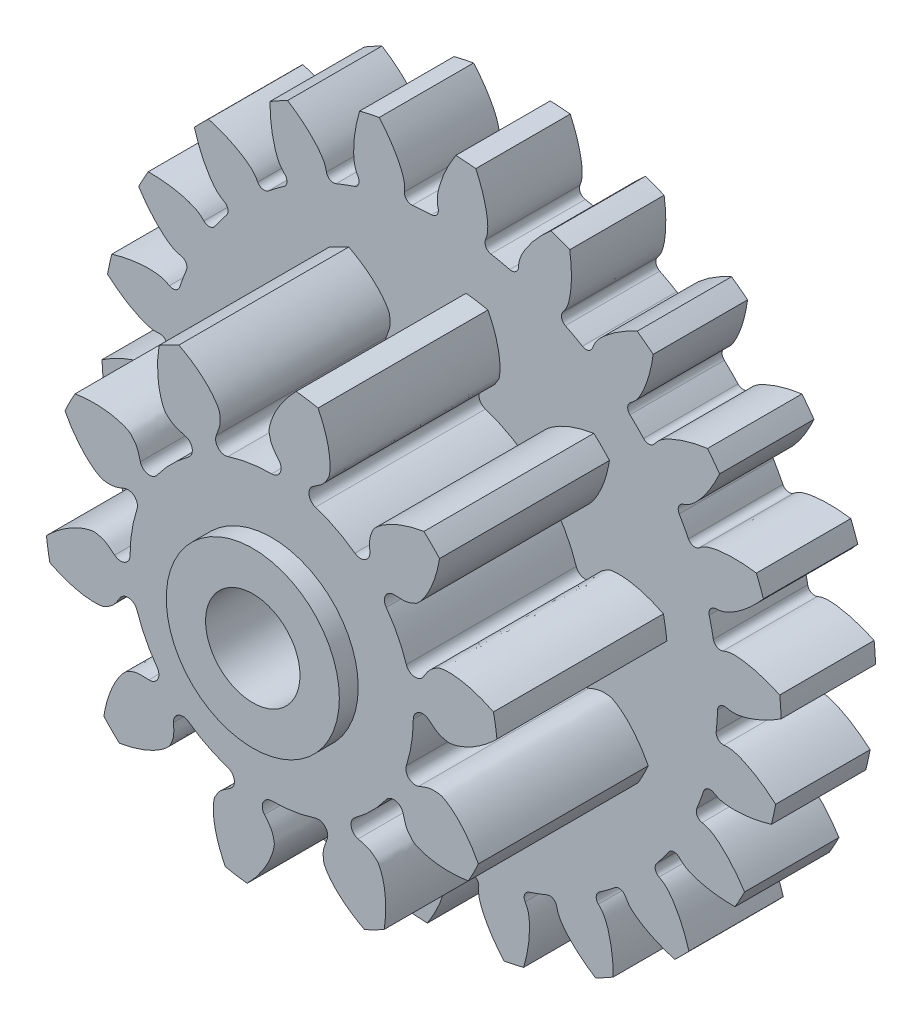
SolidWorks part; units mm, degrees
ref_plane "Face" through (0, 0, 0) normal (0, 0, 1) x (1, 0, 0)
ref_plane "Dessus" through (0, 0, 0) normal (0, 1, 0) x (1, 0, 0)
ref_plane "Droite" through (0, 0, 0) normal (1, 0, 0) x (0, 0, -1)
other "Joindre1"
other "Roue Z7 m=0,6 Z=10<1>@Z6-Z7"
other "Roue Z6 m=0,45 Z=22<1>@Z6-Z7"
sketch "Dp" plane through (0, 0, 0) normal (0, 0, -1) x (-1, 0, 0)
  circle A0 centre (0, 0) radius 4.95 construction
  circle A1 centre (0, 0) radius 3 construction
  dimension "D1" = 9.9
  dimension "D2" = 6
